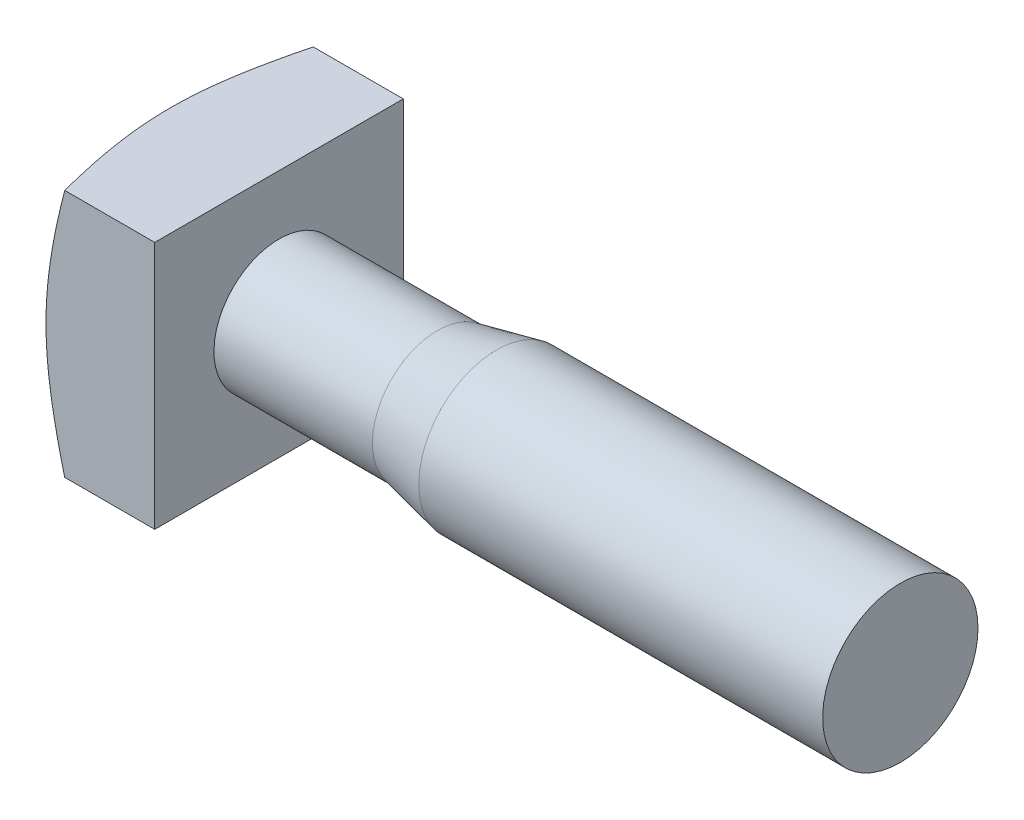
SolidWorks part; units mm, degrees
ref_plane "Front" through (0, 0, 0) normal (0, 0, 1) x (1, 0, 0)
ref_plane "Top" through (0, 0, 0) normal (0, 1, 0) x (1, 0, 0)
ref_plane "Right" through (0, 0, 0) normal (1, 0, 0) x (0, 0, -1)
sketch "Sketch1" plane through (0, 0, 0) normal (1, 0, 0) x (0, 0, -1)
  line L0 (0, 36.5746) -> (0, -34.3123) construction
  line L1 (-37.5173, 0) -> (33.3696, 0) construction
  line L3 (-8, 8) -> (8, 8)
  line L4 (-8, 8) -> (-8, -8)
  line L5 (-8, -8) -> (8, -8)
  line L6 (8, 8) -> (8, -8)
  dimension "s" = 16
extrude "BaseHead" add sketch "Sketch1" along normal blind 7
ref_plane "Plane1" through (0, 0, 0) normal (0, -0.7071, -0.7071) x (1, 0, 0)
sketch "Sketch4" plane through (-7.1814, -8, 8) normal (0, -0.7071, -0.7071) x (-1, 0, 0)
  line L0 (-16.1283, 11.3137) -> (-5.416, 11.3137) construction
  line L1 (-7.1814, 19.3137) -> (-7.1814, 22.6274)
  line L2 (-7.1814, 22.6274) -> (-8.3875, 22.6274)
  line L3 (-8.3875, 22.6274) -> (-7.1814, 19.3137)
  dimension "D1" = 20
  dimension "D2" = 16
revolve "HeadChamfer" cut sketch "Sketch4" angle 360 about L0
sketch "Sketch2" plane through (7, 0, 0) normal (1, 0, 0) x (0, 0, -1)
  circle A0 centre (0, 0) radius 5
  dimension "d" = 10
extrude "BaseBody" add sketch "Sketch2" along normal blind 40
sketch "Sketch5" plane through (-43.2091, 5, 0) normal (0, 0, 1) x (-1, 0, 0)
  line L0 (-39.4181, 5) -> (-75.6573, 5) construction
  line L1 (-64.2091, 10) -> (-50.2091, 10)
  line L2 (-50.2091, 13) -> (-50.2091, -3) construction
  line L4 (-64.2091, 10) -> (-60.4091, 9.188)
  line L5 (-60.4091, 9.188) -> (-50.2091, 9.188)
  line L6 (-90.2091, 10) -> (-90.2091, 0) construction
  line L7 (-50.2091, 10) -> (-50.2091, 9.188)
  line L8 (-50.2091, 10) -> (-90.2091, 10) construction
  dimension "b" = 26
  dimension "dz" = 8.376
  dimension "x" = 3.8
revolve "Cut-Revolve1" cut sketch "Sketch5" angle 360 about L0
sketch "Sketch6" plane through (0, 0, 0) normal (0, 0, 1) x (1, 0, 0)
  line L0 (46.594, 5.812) -> (47.406, 5.812)
  line L1 (47.406, 5.812) -> (47.406, 5)
  line L2 (47.406, 5) -> (47, 4.2968)
  line L3 (47, 4.2968) -> (46.594, 5)
  line L4 (46.594, 5) -> (46.594, 5.812)
  line L5 (47, -5) -> (47, 5) construction
  line L8 (0, 0) -> (57.2897, 0) construction
  line L9 (8.9468, 0) -> (-1.7654, 0) construction
  dimension "D1" = 0.812
  dimension "D2" = 10
revolve "Cut-Revolve10" [suppressed] cut sketch "Sketch6" angle 360
pattern_linear "LPattern10" [suppressed] count 41
equation "\"D2@Sketch4\" = \"s@Sketch1\""
equation "\"D1@Sketch6\" =  ( \"d@Sketch2\" - \"D2@ThreadCosmetic1\" )  / 2"
equation "\"pitch@LPattern10\" = 1.2 * \"D1@Sketch6\""
equation "\"D1@LPattern10\" =  \"l@BaseBody\"  / \"pitch@LPattern10\""
equation "\"D2@Sketch6\" = \"d@Sketch2\""
